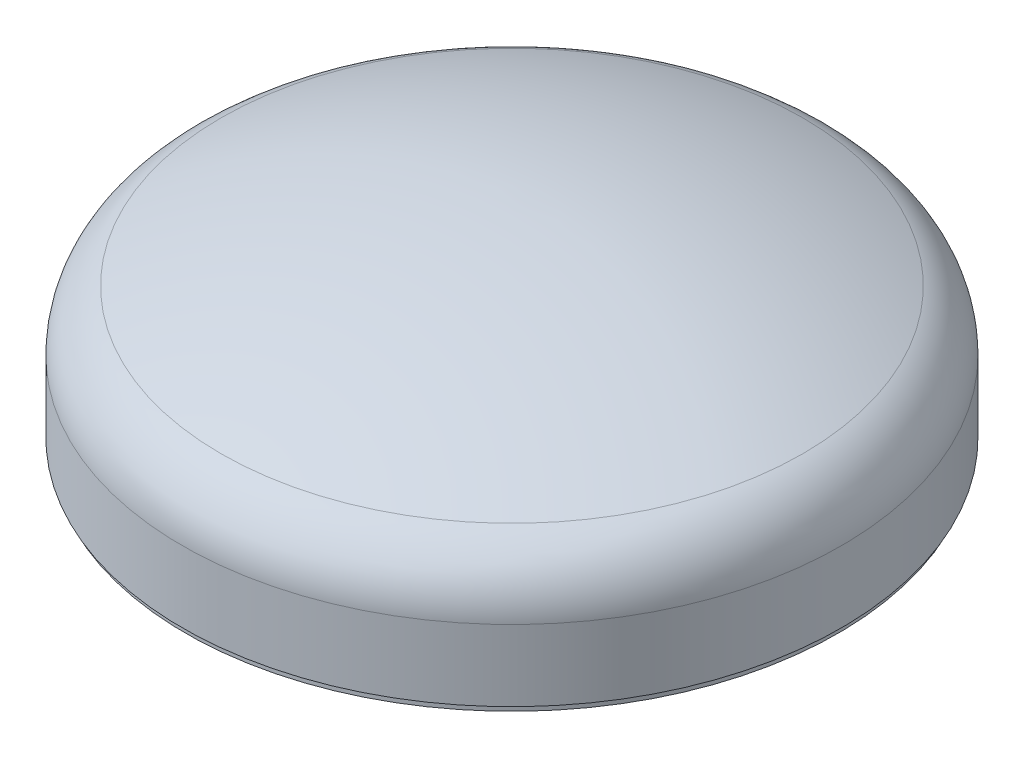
SolidWorks part; units mm, degrees
ref_plane "Plan1" through (0, 0, 0) normal (0, 0, 1) x (1, 0, 0)
ref_plane "Plan2" through (0, 0, 0) normal (0, 1, 0) x (1, 0, 0)
ref_plane "Plan3" through (0, 0, 0) normal (1, 0, 0) x (0, 0, -1)
sketch "Esquisse1" plane through (0, 0, 0) normal (0, 0, 1) x (1, 0, 0)
  line L0 (0, 0) -> (0, 1920) construction
  line L1 (0, 0) -> (620, 0) construction
  line L2 (515, 899.3681) -> (515, 793.3743)
  line L3 (0, 1100) -> (0, 1094)
  line L4 (521, 791.3743) -> (515.8038, 788.3743)
  line L5 (521, 903.8634) -> (521, 791.3743)
  line L6 (515.8038, 788.3743) -> (515.8038, 781.3743)
  line L7 (515.8038, 781.3743) -> (509.8038, 781.3743)
  line L8 (509.8038, 781.3743) -> (509.8038, 788.6423)
  line L9 (511.3038, 791.2403) -> (515, 793.3743)
  arc A0 (459.8995, 999.2459) -> (0, 1100) centre (0, 0) ccw
  arc A1 (452.8806, 995.859) -> (515, 899.3681) centre (409, 899.3681) cw
  arc A2 (452.8806, 995.859) -> (0, 1094) centre (0, 0) ccw
  arc A3 (459.8995, 999.2459) -> (521, 903.8634) centre (416, 903.8634) cw
  arc A4 (509.8038, 788.6423) -> (511.3038, 791.2403) centre (512.8038, 788.6423) cw
  point P21 (509.8038, 790.3743)
  dimension "D1" = 1100
  dimension "D3" = 106
  dimension "D5" = 1094
  dimension "D7" = 105
  dimension "D13" = 3
  dimension "D2" = 515
  dimension "D4" = 6
  dimension "D6" = 6
  dimension "D8" = 120
  dimension "D9" = 120
  dimension "D10" = 7
  dimension "D11" = 12
  dimension "D12" = 9
revolve "Base-Révolution" add sketch "Esquisse1" angle 360 about L0
ref_plane "Plan4" through (0, 788.3743, 0) normal (0, 1, 0) x (1, 0, 0)
ref_plane "Plan5" through (0, 1100, 0) normal (0, 1, 0) x (1, 0, 0)
sketch "Esquisse3" plane through (0, 1100, 0) normal (0, 1, 0) x (1, 0, 0)
  point P0 (0, 0)
